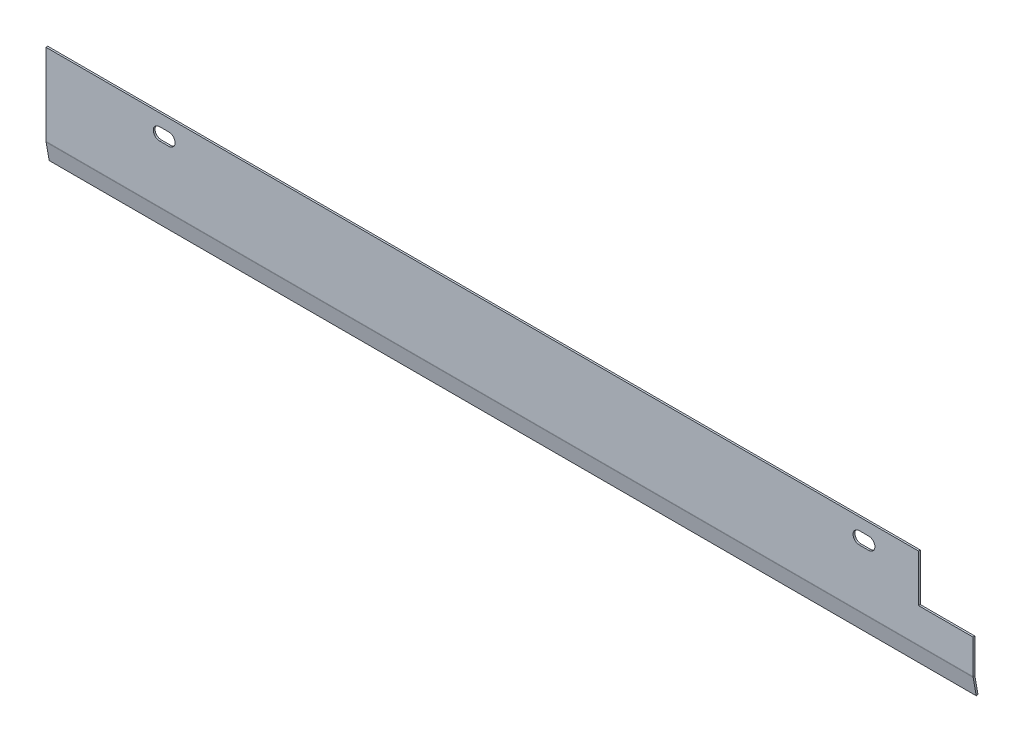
SolidWorks part; units mm, degrees
ref_plane "Plan de face" through (0, 0, 0) normal (0, 0, 1) x (1, 0, 0)
ref_plane "Plan de dessus" through (0, 0, 0) normal (0, 1, 0) x (1, 0, 0)
ref_plane "Plan de droite" through (0, 0, 0) normal (1, 0, 0) x (0, 0, -1)
mirrored part "CU031208_Rendre symétrique"
other "<CU031208>-<Enlèv. mat.-Extru.2>"
